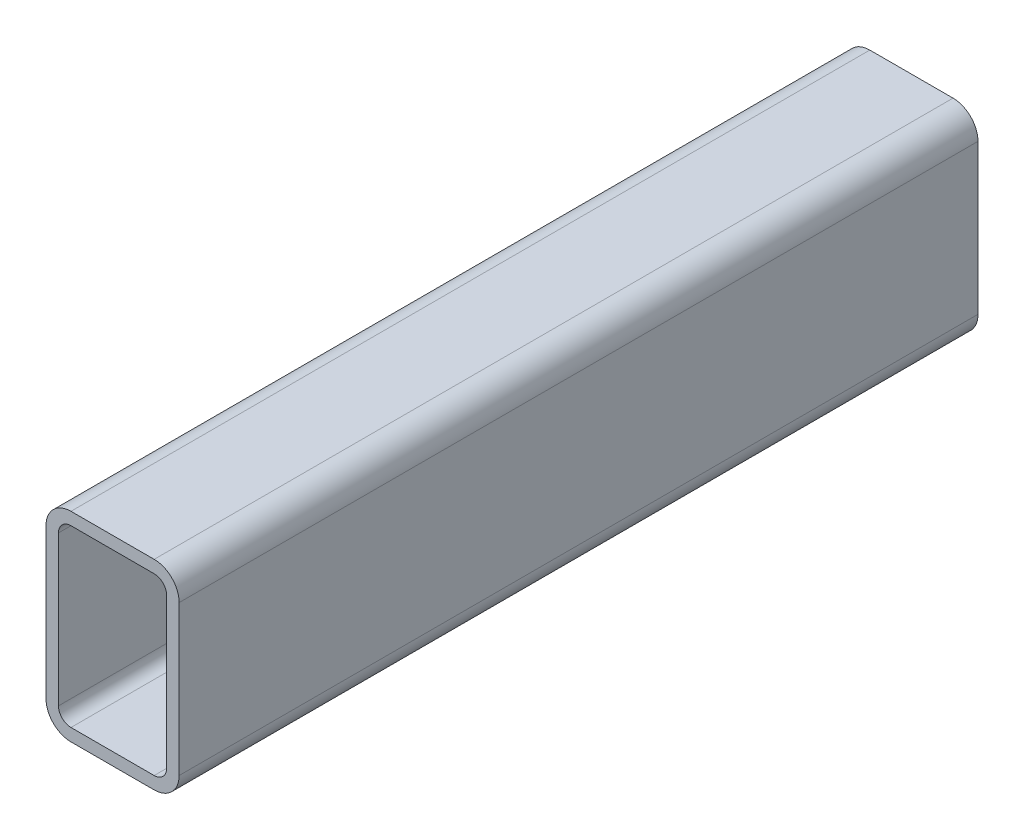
SolidWorks part; units mm, degrees
ref_plane "Front Plane" through (0, 0, 0) normal (0, 0, 1) x (1, 0, 0)
ref_plane "Top Plane" through (0, 0, 0) normal (0, 1, 0) x (1, 0, 0)
ref_plane "Right Plane" through (0, 0, 0) normal (1, 0, 0) x (0, 0, -1)
sketch "Sketch1" plane through (0, 0, 0) normal (0, 0, 1) x (1, 0, 0)
  line B0 (9.525, 76.2) -> (41.275, 76.2)
  arc B1 (50.8, 66.675) -> (41.275, 76.2) centre (41.275, 66.675) ccw
  line B2 (50.8, 66.675) -> (50.8, 9.525)
  arc B3 (41.275, 0) -> (50.8, 9.525) centre (41.275, 9.525) ccw
  line B4 (41.275, 0) -> (9.525, 0)
  arc B5 (0, 9.525) -> (9.525, 0) centre (9.525, 9.525) ccw
  line B6 (0, 9.525) -> (0, 66.675)
  arc B7 (9.525, 76.2) -> (0, 66.675) centre (9.525, 66.675) ccw
  line B8 (9.525, 71.4375) -> (41.275, 71.4375)
  arc B9 (46.0375, 66.675) -> (41.275, 71.4375) centre (41.275, 66.675) ccw
  line B10 (46.0375, 66.675) -> (46.0375, 9.525)
  arc B11 (41.275, 4.7625) -> (46.0375, 9.525) centre (41.275, 9.525) ccw
  line B12 (41.275, 4.7625) -> (9.525, 4.7625)
  arc B13 (4.7625, 9.525) -> (9.525, 4.7625) centre (9.525, 9.525) ccw
  line B14 (4.7625, 9.525) -> (4.7625, 66.675)
  arc B15 (9.525, 71.4375) -> (4.7625, 66.675) centre (9.525, 66.675) ccw
sketch_block_instance "HSS3x2x0.1875-1"
sketch_block "HSS3x2x0.1875"
extrude "Boss-Extrude1" add sketch "Sketch1" along normal blind 304.8
